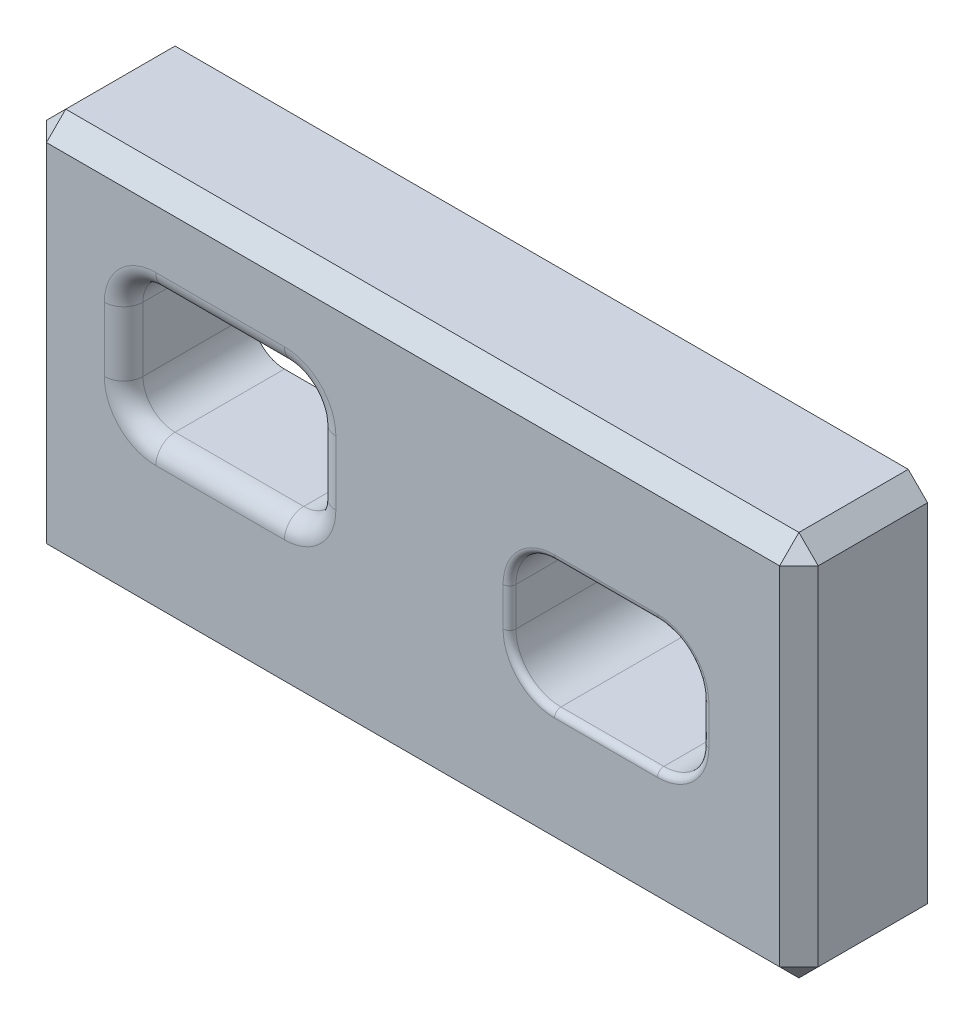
SolidWorks part; units mm, degrees
ref_plane "Front" through (0, 0, 0) normal (0, 0, 1) x (1, 0, 0)
ref_plane "Top" through (0, 0, 0) normal (0, 1, 0) x (1, 0, 0)
ref_plane "Right" through (0, 0, 0) normal (1, 0, 0) x (0, 0, -1)
sketch "Sketch1"
  dimension "D1" = 120
  dimension "D2" = 60
extrude "Extrude1" add sketch "Sketch1" along normal blind 20
sketch "Sketch2"
  dimension "D1" = 15
  dimension "D2" = 45
  dimension "D3" = 15
  dimension "D4" = 35
extrude "Cut-Extrude1" cut sketch "Sketch2" against normal blind 25.3573
sketch "Sketch3"
  dimension "D1" = 45
  dimension "D2" = 30
  dimension "D3" = 20
  dimension "D4" = 40
  dimension "D5" = 15
  dimension "D6" = 18.9548
extrude "Cut-Extrude2" cut sketch "Sketch3" against normal blind 25.3573
fillet "Fillet1" radius 5 4 edges at (45, 45, 10) (45, 25, 10) (15, 25, 10) (15, 45, 10)
fillet "Fillet2" radius 7 4 edges at (105, 40, 10) (105, 20, 10) (75, 20, 10) (75, 40, 10)
fillet "Fillet3" radius 3 8 edges at (16.4645, 26.4645, 20) (15, 35, 20) (16.4645, 43.5355, 20) (30, 45, 20) (43.5355, 43.5355, 20) (45, 35, 20) (43.5355, 26.4645, 20) (30, 25, 20)
fillet "Fillet4" radius 1 8 edges at (77.0503, 22.0503, 20) (75, 30, 20) (77.0503, 37.9497, 20) (90, 40, 20) (102.9497, 37.9497, 20) (105, 30, 20) (102.9497, 22.0503, 20) (90, 20, 20)
chamfer "Chamfer1" distance 3 angle 45 8 edges at (0, 30, 20) (0, 0, 10) (60, 0, 20) (120, 0, 10) (120, 30, 20) (120, 60, 10) (60, 60, 20) (0, 60, 10)
